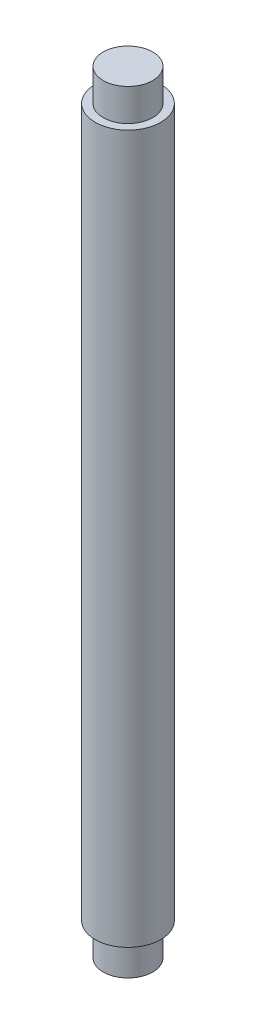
SolidWorks part; units mm, degrees
ref_plane "Front Plane" through (0, 0, 0) normal (0, 0, 1) x (1, 0, 0)
ref_plane "Top Plane" through (0, 0, 0) normal (0, 1, 0) x (1, 0, 0)
ref_plane "Right Plane" through (0, 0, 0) normal (1, 0, 0) x (0, 0, -1)
ref_plane "Plane1" through (0, 0, 0) normal (0, 0, -1) x (-1, 0, 0)
sketch "Sketch1" plane through (0, 0, 0) normal (0, 0, -1) x (-1, 0, 0)
  line L0 (-2.54, -7.112) -> (7.239, -7.112)
  line L1 (7.239, -7.112) -> (7.239, 297.688)
  line L2 (7.239, 297.688) -> (-2.54, 297.688)
  line L3 (-2.54, 297.688) -> (-2.54, 284.988)
  line L4 (-2.54, 284.988) -> (-5.715, 284.988)
  line L5 (-5.715, 284.988) -> (-5.715, 5.588)
  line L6 (-5.715, 5.588) -> (-2.54, 5.588)
  line L7 (-2.54, 5.588) -> (-2.54, -7.112)
  line L8 (7.239, -7.112) -> (7.239, 297.688) construction
  dimension "D1" = 304.8
  dimension "D2" = 279.4
  dimension "D3" = 9.779
  dimension "D4" = 3.175
revolve "Revolve1" add sketch "Sketch1" angle 360 about L8
